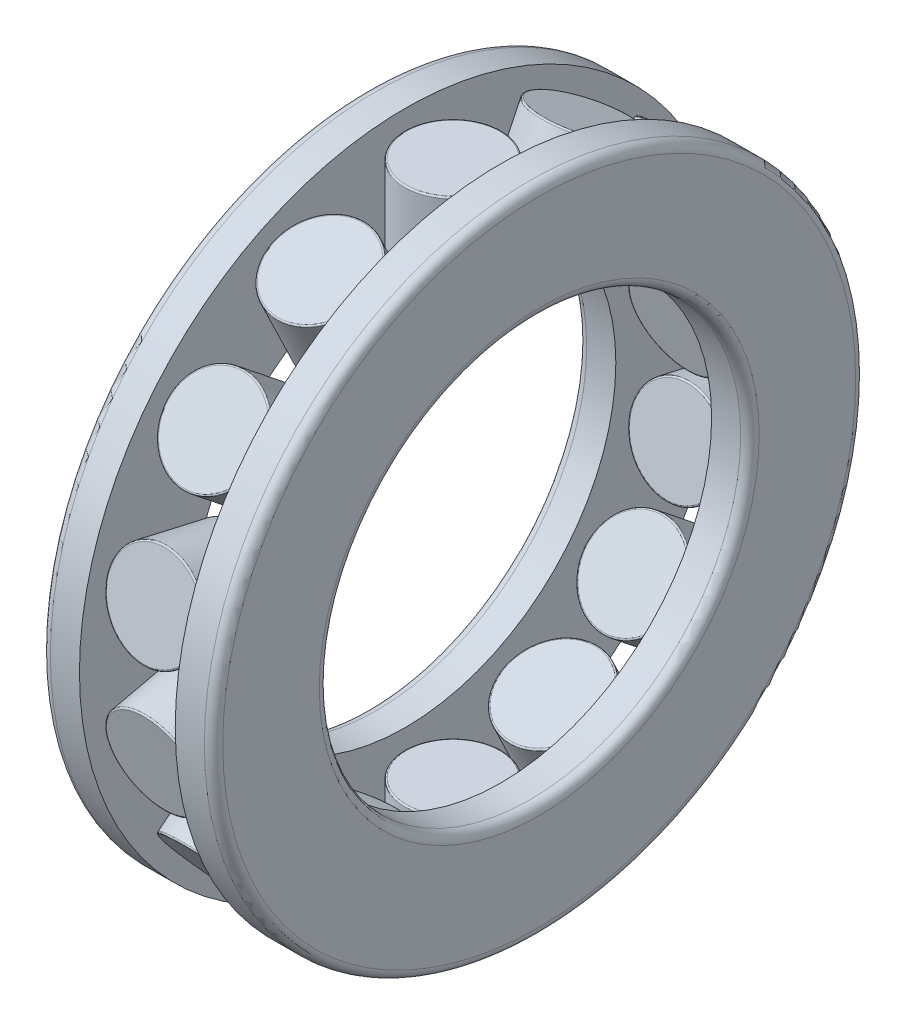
SolidWorks part; units mm, degrees
ref_plane "Plane1" through (0, 0, 0) normal (0, 0, 1) x (1, 0, 0)
ref_plane "Plane2" through (0, 0, 0) normal (0, 1, 0) x (1, 0, 0)
ref_plane "Plane3" through (0, 0, 0) normal (1, 0, 0) x (0, 0, -1)
sketch "Clipboard" plane through (0, 0, 0) normal (0, 0, 1) x (1, 0, 0)
  line L0 (-10, 0) -> (10, 0) construction
  line L1 (0, 0) -> (21.6965, -5.4095)
  line L2 (0, 0) -> (27.3662, 35.0271)
  line L3 (0, 0) -> (13.7666, -17.6205)
  line L4 (0, 0) -> (-22.3471, -0.7804)
  dimension "BallCLRad" = 44.45
  dimension "Count" = 52
  dimension "Show_count" = 52
  dimension "Max_count" = 14
  dimension "Min_count" = 2
sketch "InnRacSke" plane through (0, 0, 0) normal (0, 0, 1) x (1, 0, 0)
  line L1 (-7.9375, 34.925) -> (-12.7635, 34.925)
  line L2 (-14.2875, 36.449) -> (-14.2875, 52.451)
  line L3 (-12.7635, 53.975) -> (-7.9375, 53.975)
  line L4 (-7.9375, 53.975) -> (-7.9375, 34.925)
  line L5 (-34.925, 0) -> (34.925, 0) construction
  line L6 (0, 0) -> (0, 25.4) construction
  arc A0 (-12.7635, 34.925) -> (-14.2875, 36.449) centre (-12.7635, 36.449) cw
  arc A1 (-14.2875, 52.451) -> (-12.7635, 53.975) centre (-12.7635, 52.451) cw
  dimension "ID" = 69.85
  dimension "OD" = 107.95
  dimension "Width" = 28.575
  dimension "gap" = 15.875
revolve "Race" add sketch "InnRacSke" angle 360 about L5
ref_axis "Axis1" through (-50, 0, 0) along (1, 0, 0)
sketch "RolDetSke" plane through (0, 0, 0) normal (0, 0, 1) x (1, 0, 0)
  line L0 (0, 33.02) -> (0, 55.88) construction
  line L3 (0, 50.8) -> (7.7232, 50.8)
  line L4 (0, 50.8) -> (0, 38.1)
  line L5 (0, 38.1) -> (7.7232, 38.1)
  line L6 (7.9772, 50.546) -> (7.9772, 38.354)
  arc A0 (7.9772, 38.354) -> (7.7232, 38.1) centre (7.7232, 38.354) cw
  arc A1 (7.7232, 50.8) -> (7.9772, 50.546) centre (7.7232, 50.546) cw
  dimension "D1" = 0.254
  dimension "Roller_diameter" = 15.9544
  dimension "Cyl_Len" = 12.7
  dimension "offset" = 38.1
revolve "RollerDetailed" add sketch "RolDetSke" angle 360 about L0
sketch "RolSimSke" plane through (0, 0, 0) normal (0, 0, 1) x (1, 0, 0)
  line L1 (-17.78, 0) -> (12.7, 0) construction
  line L3 (-7.7232, 50.8) -> (7.7232, 50.8)
  line L4 (-7.9772, 50.546) -> (-7.9772, 38.354)
  line L5 (-7.7232, 38.1) -> (7.7232, 38.1)
  line L6 (7.9772, 50.546) -> (7.9772, 38.354)
  arc A0 (-7.9772, 38.354) -> (-7.7232, 38.1) centre (-7.7232, 38.354) ccw
  arc A1 (-7.7232, 50.8) -> (-7.9772, 50.546) centre (-7.7232, 50.546) ccw
  arc A2 (7.9772, 50.546) -> (7.7232, 50.8) centre (7.7232, 50.546) ccw
  arc A3 (7.7232, 38.1) -> (7.9772, 38.354) centre (7.7232, 38.354) ccw
  dimension "Rol_rad" = 0.254
  dimension "Roller_diameter" = 15.9544
  dimension "Cyl_Len" = 12.7
  dimension "offset" = 38.1
  dimension "Halfdia" = 7.9772
revolve "RollersSimplified" [suppressed] add sketch "RolSimSke" angle 360 about L1
mirror "Mirror1" about plane through (0, 0, 0) normal (1, 0, 0) of "Race"
pattern_circular "RollersDetailed" count 14 every 25.714 about axis through (-50, 0, 0) along (1, 0, 0) of "RollerDetailed"
sketch "CagSpiSke" plane through (0, 0, 0) normal (0, 0, 1) x (1, 0, 0)
  line L0 (2.3932, 35.6235) -> (2.3932, 52.8955)
  line L1 (2.3932, 52.8955) -> (-2.3932, 52.8955)
  line L2 (-2.3932, 35.6235) -> (-2.3932, 52.8955)
  line L3 (-2.3932, 35.6235) -> (2.3932, 35.6235)
  line L4 (-34.925, 0) -> (34.925, 0) construction
  line L5 (0, 0) -> (0, 63.6264) construction
  dimension "Thickness" = 4.7863
  dimension "ID" = 71.247
  dimension "OD" = 105.791
revolve "CageSpine" [suppressed] add sketch "CagSpiSke" angle 360 about L4
equation "\"BallCLRad@Clipboard\" =  ( \"OD@InnRacSke\" + \"ID@InnRacSke\" )  / 4"
equation "\"offset@RolDetSke\" = \"BallCLRad@Clipboard\" - \"Cyl_Len@RolDetSke\" / 2"
equation "\"Cyl_Len@RolSimSke\" = \"Cyl_Len@RolDetSke\""
equation "\"offset@RolSimSke\" = \"BallCLRad@Clipboard\" - \"Cyl_Len@RolSimSke\" / 2"
equation "\"Roller_diameter@RolDetSke\" = \"gap@InnRacSke\" * 1.005"
equation "\"Roller_diameter@RolSimSke\" = \"gap@InnRacSke\" * 1.005"
equation "\"Max_count@Clipboard\" = int( 3.14159265 / atn(( \"Roller_diameter@RolDetSke\" / 2) / sqr( \"offset@RolDetSke\"  *  \"offset@RolDetSke\" - ( \"Roller_diameter@RolDetSke\" / 2) *  ( \"Roller_diameter@RolDetSke\" "
equation "\"Max_count@Clipboard\" = ((sgn( \"Max_count@Clipboard\" - \"Count@Clipboard\" )-1)*( \"Max_count@Clipboard\" - \"Count@Clipboard\" ))/-2+ \"Count@Clipboard\""
equation "\"Count@RollersDetailed\" = int( \"Show_count@Clipboard\" ) "
equation "\"Count@RollersDetailed\" = ((sgn( \"Count@RollersDetailed\" - \"Max_count@Clipboard\" )-1)*( \"Count@RollersDetailed\" - \"Max_count@Clipboard\" ))/-2+ \"Max_count@Clipboard\""
equation "\"Count@RollersDetailed\" = ((sgn( \"Count@RollersDetailed\" - \"Min_count@Clipboard\" )+1)*( \"Count@RollersDetailed\" - \"Min_count@Clipboard\"))/2 +\"Min_count@Clipboard\""
equation "\"Angle@RollersDetailed\" = 360.0 / \"Max_count@Clipboard\""
equation "\"Angle@CageSpine\" =  \"Angle@RollersDetailed\" * ( \"Count@RollersDetailed\" -1 + int( \"Count@RollersDetailed\" / \"Max_count@Clipboard\" ) )  + 0.001 -  int( \"Count@RollersDetailed\" / \"Max_count@Clipboard\" "
equation "\"Angle@CageSpine\" =  \"Angle@CageSpine\" * int( \"Min_count@Clipboard\" / 2) + int(1 / \"Min_count@Clipboard\")  * 0.001"
equation "\"Thickness@CagSpiSke\" =  \"Roller_diameter@RolDetSke\" * 0.3"
equation "\"OD@CagSpiSke\" =  \"OD@InnRacSke\" * 0.98"
equation "\"ID@CagSpiSke\" =  \"ID@InnRacSke\" * 1.02"
equation "\"Halfdia@RolSimSke\" = \"Roller_diameter@RolSimSke\" / 2"
